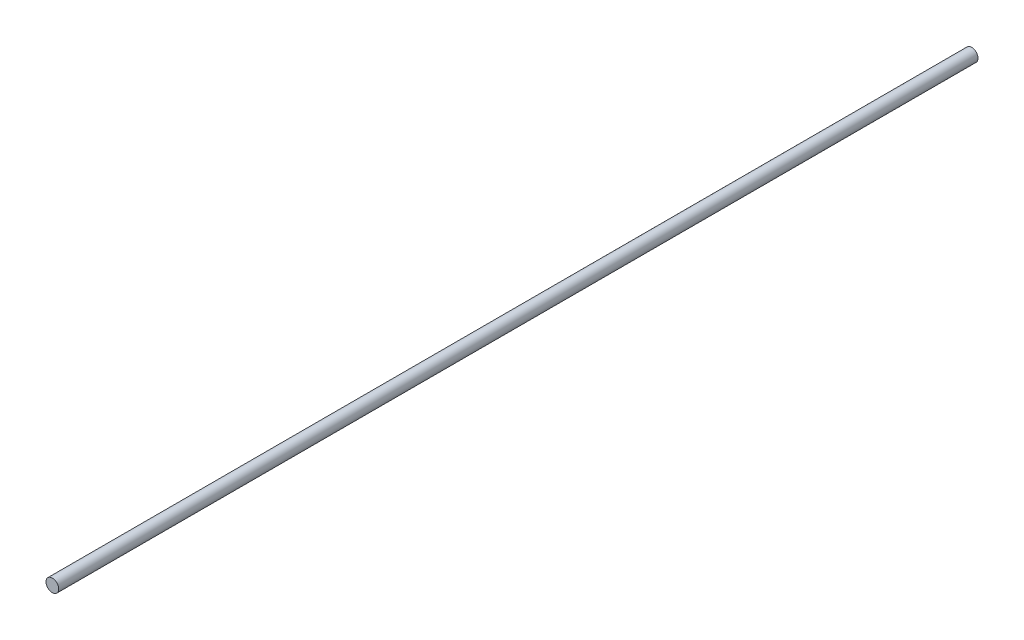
SolidWorks part; units mm, degrees
ref_plane "Front Plane" through (0, 0, 0) normal (0, 0, 1) x (1, 0, 0)
ref_plane "Top Plane" through (0, 0, 0) normal (0, 1, 0) x (1, 0, 0)
ref_plane "Right Plane" through (0, 0, 0) normal (1, 0, 0) x (0, 0, -1)
sketch "Sketch1" plane through (0, 0, 0) normal (0, 0, 1) x (1, 0, 0)
  circle A0 centre (0, 0) radius 30
  dimension "D1" = 60
extrude "Boss-Extrude1" add sketch "Sketch1" against normal blind 4350
